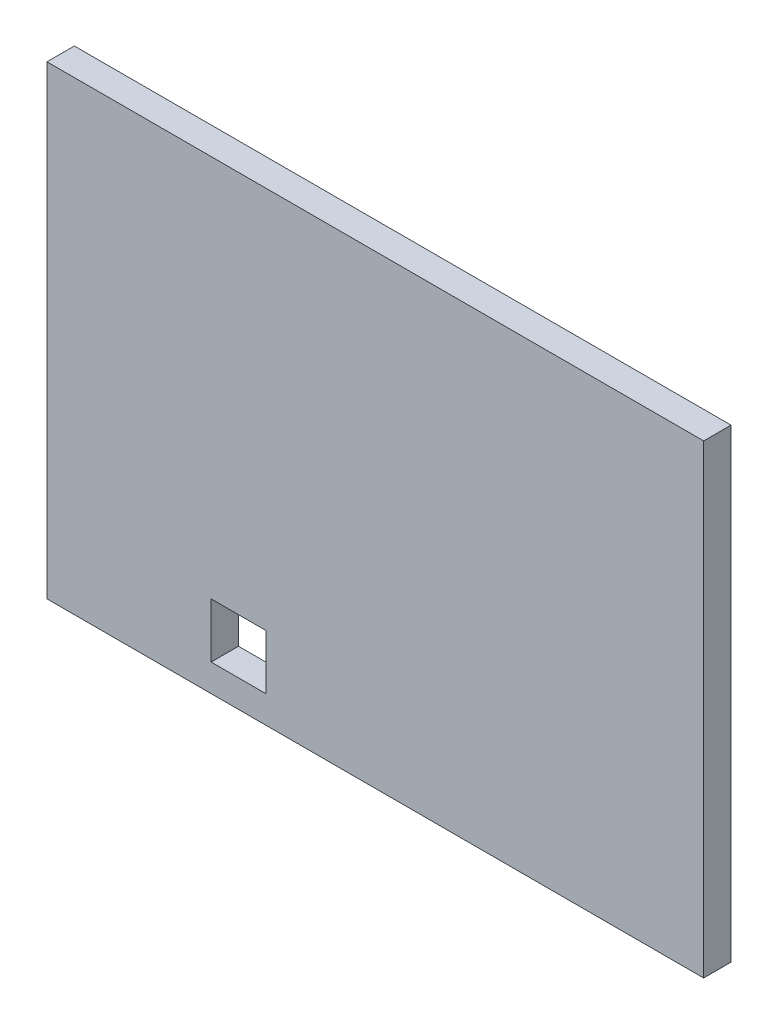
SolidWorks part; units mm, degrees
ref_plane "前视基准面" through (0, 0, 0) normal (0, 0, 1) x (1, 0, 0)
ref_plane "上视基准面" through (0, 0, 0) normal (0, 1, 0) x (1, 0, 0)
ref_plane "右视基准面" through (0, 0, 0) normal (1, 0, 0) x (0, 0, -1)
other "Configuration Table"
sketch "草图1" plane through (0, 0, 0) normal (0, 0, 1) x (1, 0, 0)
  line L1 (60, -42.5) -> (-60, -42.5)
  line L2 (60, -42.5) -> (60, 42.5)
  line L3 (60, 42.5) -> (-60, 42.5)
  line L4 (-60, -42.5) -> (-60, 42.5)
  line L5 (60, -42.5) -> (-60, 42.5) construction
  line L6 (60, 42.5) -> (-60, -42.5) construction
  point P0 (0, 0)
  dimension "D1" = 120
  dimension "D2" = 85
extrude "凸台-拉伸1" add sketch "草图1" along normal blind 5
sketch "草图3" plane through (0, 0, 5) normal (0, 0, 1) x (1, 0, 0)
  line L0 (-60, -42.5) -> (60, -42.5) construction
  line L1 (-30, -27.5) -> (-20, -27.5)
  line L2 (-30, -27.5) -> (-30, -37.5)
  line L3 (-30, -37.5) -> (-20, -37.5)
  line L4 (-20, -27.5) -> (-20, -37.5)
  line L5 (-30, -27.5) -> (-20, -37.5) construction
  line L6 (-30, -37.5) -> (-20, -27.5) construction
  line L7 (-60, 42.5) -> (-60, -42.5) construction
  point P0 (-25, -32.5)
  dimension "D1" = 10
  dimension "D2" = 5
  dimension "D3" = 30
extrude "切除-拉伸1" cut sketch "草图3" against normal blind 10 contours L1 L4 L3 L2
